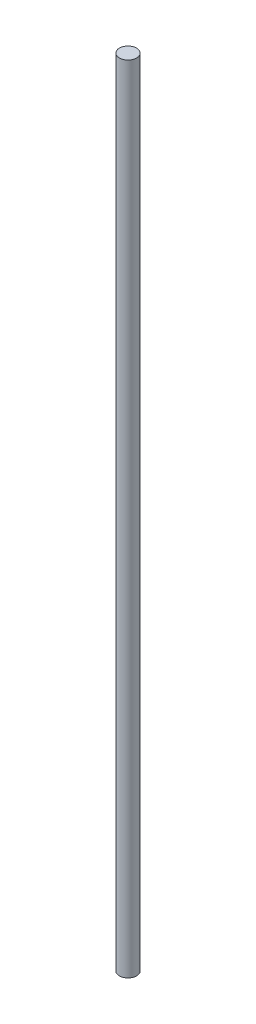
SolidWorks part; units mm, degrees
ref_plane "Piano frontale" through (0, 0, 0) normal (0, 0, 1) x (1, 0, 0)
ref_plane "Piano superiore" through (0, 0, 0) normal (0, 1, 0) x (1, 0, 0)
ref_plane "Piano destro" through (0, 0, 0) normal (1, 0, 0) x (0, 0, -1)
sketch "Schizzo1" plane through (0, 0, 0) normal (0, 1, 0) x (1, 0, 0)
  circle A0 centre (0, 0) radius 2
  dimension "D1" = 4
extrude "Estrusione-Estrusione1" add sketch "Schizzo1" along normal blind 185
